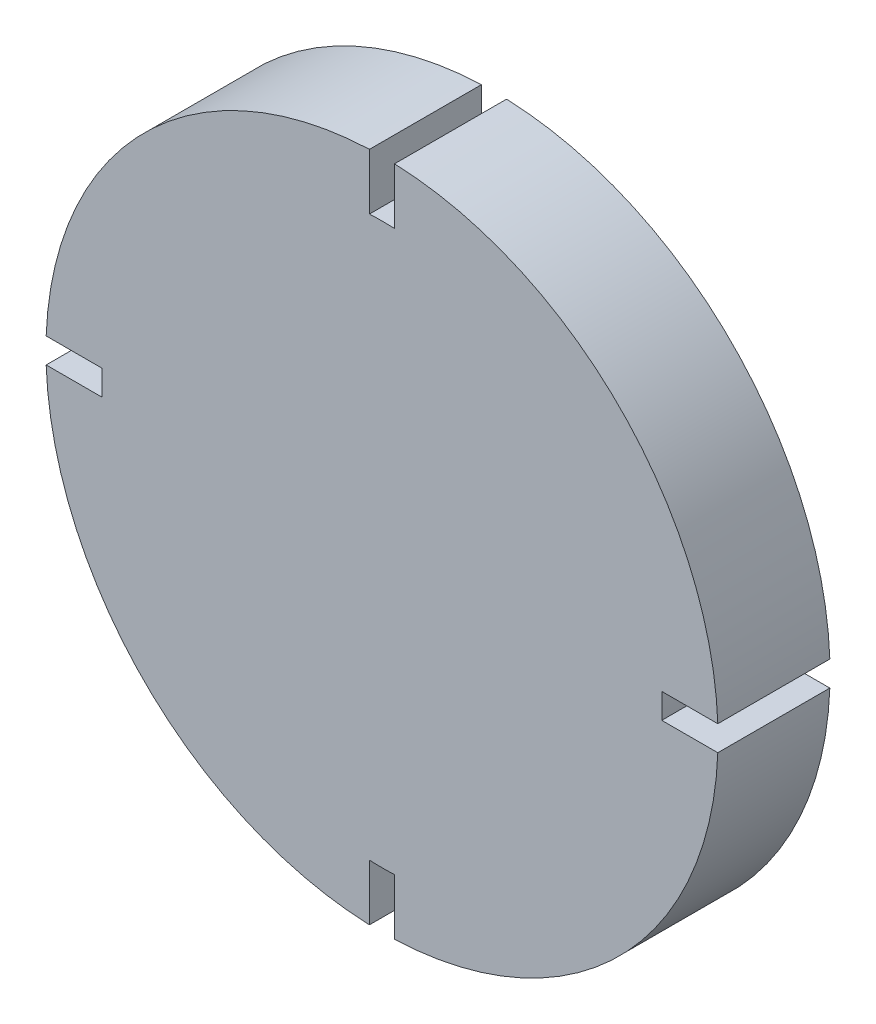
SolidWorks part; units mm, degrees
ref_plane "Front Plane" through (0, 0, 0) normal (0, 0, 1) x (1, 0, 0)
ref_plane "Top Plane" through (0, 0, 0) normal (0, 1, 0) x (1, 0, 0)
ref_plane "Right Plane" through (0, 0, 0) normal (1, 0, 0) x (0, 0, -1)
sketch "Sketch1" plane through (0, 0, 0) normal (0, 0, 1) x (1, 0, 0)
  line L0 (0, 28.8689) -> (0, -28.1078) construction
  line L1 (-35.3866, 0) -> (30.0784, 0) construction
  line L2 (-1.12, 29.9791) -> (-1.12, 24.9749)
  line L3 (1.12, 29.9791) -> (1.12, 24.9749)
  line L4 (29.9791, 1.12) -> (24.9749, 1.12)
  line L5 (29.9791, -1.12) -> (24.9749, -1.12)
  line L6 (1.12, -29.9791) -> (1.12, -24.9749)
  line L7 (-1.12, -29.9791) -> (-1.12, -24.9749)
  line L8 (-29.9791, -1.12) -> (-24.9749, -1.12)
  line L9 (-29.9791, 1.12) -> (-24.9749, 1.12)
  arc A0 (-29.9791, -1.12) -> (-1.12, -29.9791) centre (0, 0) ccw
  arc A1 (1.12, 24.9749) -> (-1.12, 24.9749) centre (0, 0) ccw
  arc A2 (1.12, -29.9791) -> (29.9791, -1.12) centre (0, 0) ccw
  arc A3 (29.9791, 1.12) -> (1.12, 29.9791) centre (0, 0) ccw
  arc A4 (-1.12, 29.9791) -> (-29.9791, 1.12) centre (0, 0) ccw
  arc A5 (-24.9749, 1.12) -> (-24.9749, -1.12) centre (0, 0) ccw
  arc A6 (-1.12, -24.9749) -> (1.12, -24.9749) centre (0, 0) ccw
  arc A7 (24.9749, -1.12) -> (24.9749, 1.12) centre (0, 0) ccw
  point P27 (0, 0)
extrude "Boss-Extrude1" add sketch "Sketch1" along normal blind 10
equation "\"D1@Sketch1\"= 10 + \"A\""
equation "\"A\" = 50"
equation "\"A@Sketch1\"=\"A\""
equation "\"D3@Sketch1\"=56/\"A\""
